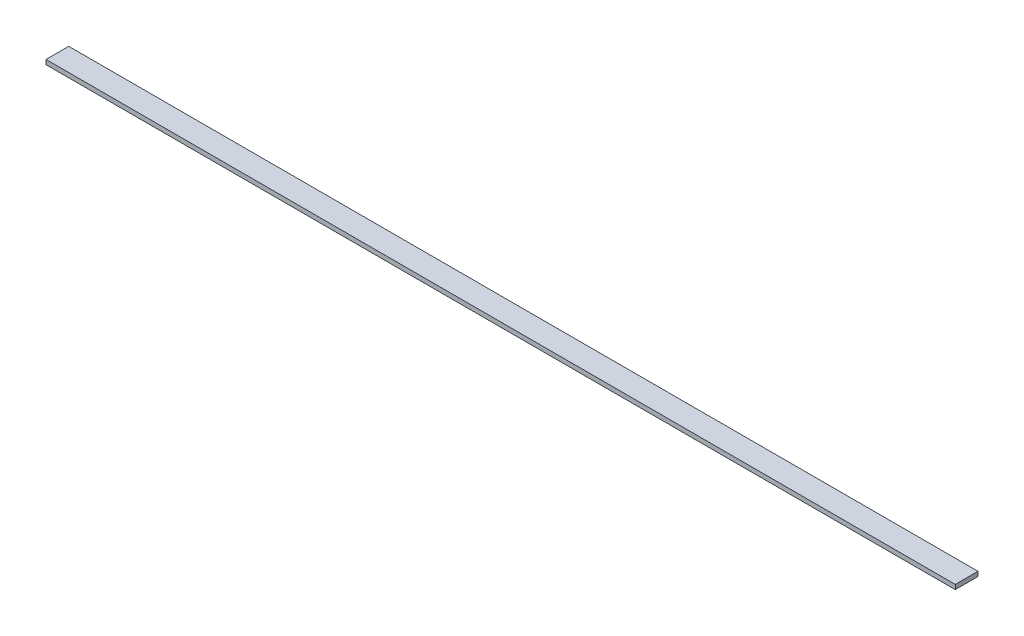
SolidWorks part; units mm, degrees
ref_plane "Plan de face" through (0, 0, 0) normal (0, 0, 1) x (1, 0, 0)
ref_plane "Plan de dessus" through (0, 0, 0) normal (0, 1, 0) x (1, 0, 0)
ref_plane "Plan de droite" through (0, 0, 0) normal (1, 0, 0) x (0, 0, -1)
sketch "Esquisse1" plane through (0, 0, 0) normal (0, 0, 1) x (1, 0, 0)
  line L1 (0, 0) -> (20000, 0)
  line L2 (0, 0) -> (0, 100)
  line L3 (0, 100) -> (20000, 100)
  line L4 (20000, 0) -> (20000, 100)
  dimension "D1" = 100
  dimension "D2" = 20000
  dimension "D3" = 90
extrude "Extrusion1" add sketch "Esquisse1" along normal mid plane 500
